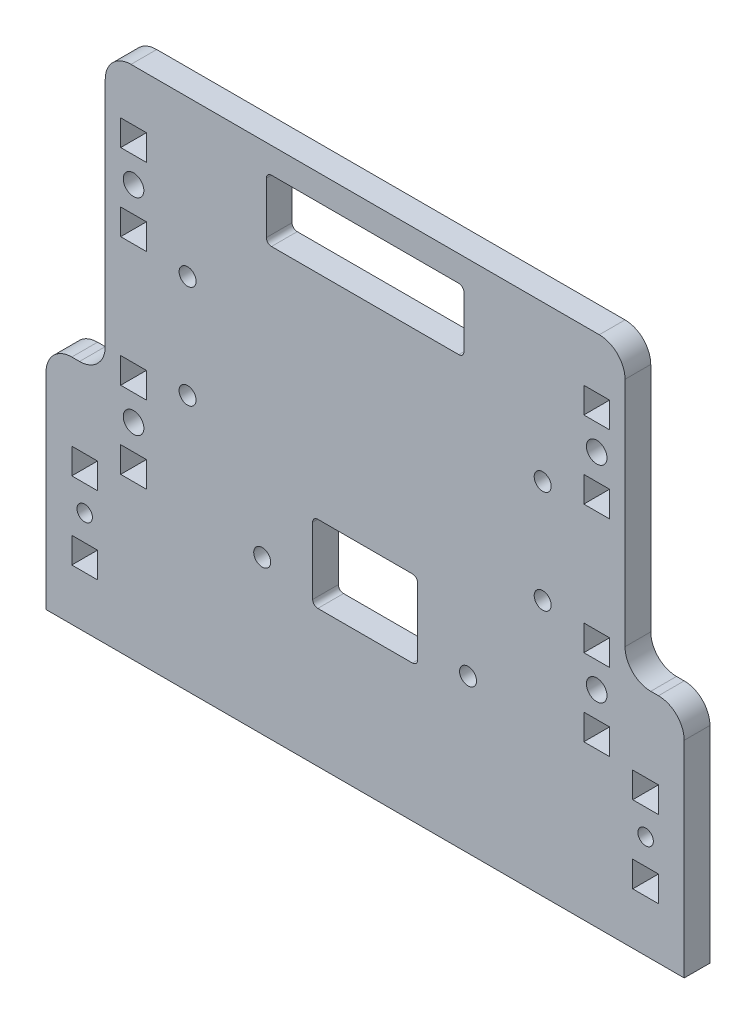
SolidWorks part; units mm, degrees
other "<Batterie_Makita_Adaptateur_Base_5mm>-<Fillet2>"
other "<Batterie_Makita_Adaptateur_Base_5mm>-<<Batterie_Makita_Adaptateur_base_2mm>-<Fillet2>>"
ref_plane "Plan de face" through (0, 0, 0) normal (0, 0, 1) x (1, 0, 0)
ref_plane "Plan de dessus" through (0, 0, 0) normal (0, 1, 0) x (1, 0, 0)
ref_plane "Plan de droite" through (0, 0, 0) normal (1, 0, 0) x (0, 0, -1)
inserted part "Batterie_Makita_Adaptateur_Base_5mm"
delete or keep bodies "Corps-Supprimer/Garder 1" type delete bodies bodies 101
sketch "Esquisse2" plane through (0, 0, 22.1286) normal (0, 0, 1) x (1, 0, 0)
  line L0 (15.5136, 32.73) -> (-57.4864, 32.73) construction
  line L1 (-57.4864, 32.73) -> (-71.4864, 32.73)
  line L2 (-57.4864, 32.73) -> (-57.4864, -52.47)
  line L3 (-57.4864, -52.47) -> (-71.4864, -52.47)
  line L4 (-71.4864, 32.73) -> (-71.4864, -52.47)
  line L5 (-20.9864, 32.73) -> (-20.9864, -52.47) construction
  line L6 (-57.4864, -52.47) -> (15.5136, -52.47) construction
  line L7 (15.5136, 32.73) -> (29.5136, 32.73)
  line L8 (15.5136, 32.73) -> (15.5136, -52.47)
  line L9 (15.5136, -52.47) -> (29.5136, -52.47)
  line L10 (29.5136, 32.73) -> (29.5136, -52.47)
  arc A0 (-57.4864, 32.73) -> (-60.4864, 29.73) centre (-57.4864, 29.73) ccw construction
  point P13 (-70.7604, 24.1803)
  line B0 (-65.9864, 17.73) -> (-65.9864, 7.73) construction
  line B1 (-63.4864, 17.73) -> (-63.4864, 22.73)
  line B2 (-63.4864, 17.73) -> (-68.4864, 17.73)
  line B3 (-68.4864, 17.73) -> (-68.4864, 22.73)
  line B4 (-63.4864, 22.73) -> (-68.4864, 22.73)
  line B5 (-63.4864, 7.73) -> (-63.4864, 2.73)
  line B6 (-63.4864, 7.73) -> (-68.4864, 7.73)
  line B7 (-68.4864, 7.73) -> (-68.4864, 2.73)
  line B8 (-63.4864, 2.73) -> (-68.4864, 2.73)
  line B9 (-65.9864, 12.73) -> (-59.014, 12.73) construction
  circle B10 centre (-65.9864, 12.73) radius 2
  line B11 (-65.9864, -22.27) -> (-65.9864, -32.27) construction
  line B12 (-63.4864, -22.27) -> (-63.4864, -17.27)
  line B13 (-63.4864, -22.27) -> (-68.4864, -22.27)
  line B14 (-68.4864, -22.27) -> (-68.4864, -17.27)
  line B15 (-63.4864, -17.27) -> (-68.4864, -17.27)
  line B16 (-63.4864, -32.27) -> (-63.4864, -37.27)
  line B17 (-63.4864, -32.27) -> (-68.4864, -32.27)
  line B18 (-68.4864, -32.27) -> (-68.4864, -37.27)
  line B19 (-63.4864, -37.27) -> (-68.4864, -37.27)
  line B20 (-65.9864, -27.27) -> (-59.014, -27.27) construction
  circle B21 centre (-65.9864, -27.27) radius 2
  line B22 (21.5136, -22.27) -> (21.5136, -17.27)
  line B23 (21.5136, -22.27) -> (26.5136, -22.27)
  line B24 (26.5136, -22.27) -> (26.5136, -17.27)
  line B25 (21.5136, -17.27) -> (26.5136, -17.27)
  line B26 (21.5136, -32.27) -> (21.5136, -37.27)
  line B27 (21.5136, -32.27) -> (26.5136, -32.27)
  line B28 (26.5136, -32.27) -> (26.5136, -37.27)
  line B29 (21.5136, -37.27) -> (26.5136, -37.27)
  circle B30 centre (24.0136, -27.27) radius 2
  line B31 (21.5136, 17.73) -> (21.5136, 22.73)
  line B32 (21.5136, 17.73) -> (26.5136, 17.73)
  line B33 (26.5136, 17.73) -> (26.5136, 22.73)
  line B34 (21.5136, 22.73) -> (26.5136, 22.73)
  line B35 (21.5136, 7.73) -> (21.5136, 2.73)
  line B36 (21.5136, 7.73) -> (26.5136, 7.73)
  line B37 (26.5136, 7.73) -> (26.5136, 2.73)
  line B38 (21.5136, 2.73) -> (26.5136, 2.73)
  circle B39 centre (24.0136, 12.73) radius 2
  dimension "D1" = 85
  dimension "D2" = 10
  dimension "D3" = 40
  dimension "D4" = 3
sketch_block_instance "Trou M4 plots 5mm-1"
sketch_block "Trou M4 plots 5mm" parameters "D2"=4, "D1"=5, "D3"=5, "D4"=10
sketch_block_instance "Trou M4 plots 5mm-3"
sketch_block_instance "Trou M4 plots 5mm-4"
sketch_block_instance "Trou M4 plots 5mm-5"
extrude "Boss.-Extru.2" add sketch "Esquisse2" against normal up to vertex
fillet "Congé1" radius 5 4 edges at (-71.4864, -52.47, 19.6286) (29.5136, -52.47, 19.6286) (29.5136, 32.73, 19.6286) (-71.4864, 32.73, 19.6286)
sketch "Esquisse3" plane through (0, 0, 22.1286) normal (0, 0, 1) x (1, 0, 0)
  line L8 (-20.9864, -47.47) -> (-20.9864, 27.0963) construction
  line L11 (24.5136, 32.73) -> (-66.4864, 32.73) construction
  line L12 (-20.9864, 32.73) -> (-20.9864, -52.47) construction
  line L13 (-66.4864, -52.47) -> (24.5136, -52.47) construction
  line L14 (-71.4864, -22.27) -> (-82.9864, -22.27)
  line L15 (-82.9864, -22.27) -> (-82.9864, -67.27)
  line L16 (41.0136, -67.27) -> (41.0136, -22.27)
  line L17 (41.0136, -22.27) -> (29.5136, -22.27)
  line L18 (29.5136, -22.27) -> (29.5136, -47.47)
  line L21 (-71.4864, -47.47) -> (-71.4864, -22.27)
  line L22 (-82.9864, -67.27) -> (41.0136, -67.27)
  line L23 (-71.4864, -47.47) -> (29.5136, -47.47)
  point P0 (-87.037, -24.7163)
  point P1 (-20.9864, -47.47)
  line B0 (36.0136, -42.27) -> (36.0136, -37.27)
  line B1 (36.0136, -42.27) -> (31.0136, -42.27)
  line B2 (31.0136, -42.27) -> (31.0136, -37.27)
  line B3 (36.0136, -37.27) -> (31.0136, -37.27)
  line B4 (36.0136, -52.27) -> (36.0136, -57.27)
  line B5 (36.0136, -52.27) -> (31.0136, -52.27)
  line B6 (31.0136, -52.27) -> (31.0136, -57.27)
  line B7 (36.0136, -57.27) -> (31.0136, -57.27)
  circle B8 centre (33.5136, -47.27) radius 1.5
  line B9 (-77.9864, -42.27) -> (-77.9864, -37.27)
  line B10 (-77.9864, -42.27) -> (-72.9864, -42.27)
  line B11 (-72.9864, -42.27) -> (-72.9864, -37.27)
  line B12 (-77.9864, -37.27) -> (-72.9864, -37.27)
  line B13 (-77.9864, -52.27) -> (-77.9864, -57.27)
  line B14 (-77.9864, -52.27) -> (-72.9864, -52.27)
  line B15 (-72.9864, -52.27) -> (-72.9864, -57.27)
  line B16 (-77.9864, -57.27) -> (-72.9864, -57.27)
  circle B17 centre (-75.4864, -47.27) radius 1.5
  dimension "D1" = 11.5
  dimension "D2" = 1.5
  dimension "D3" = 10
  dimension "D4" = 14.8
  dimension "D5" = 30.2
  dimension "D6" = 124
sketch_block_instance "Trou M3 plots 5mm-2-2"
sketch_block "Trou M3 plots 5mm-2" parameters "D2"=3, "D1"=5, "D3"=5, "D4"=10
sketch_block_instance "Trou M3 plots 5mm-2-3"
extrude "Boss.-Extru.3" add sketch "Esquisse3" against normal up to vertex
fillet "Congé2" radius 5 4 edges at (-82.9864, -22.27, 19.6286) (-71.4864, -22.27, 19.6286) (41.0136, -22.27, 19.6286) (29.5136, -22.27, 19.6286)
